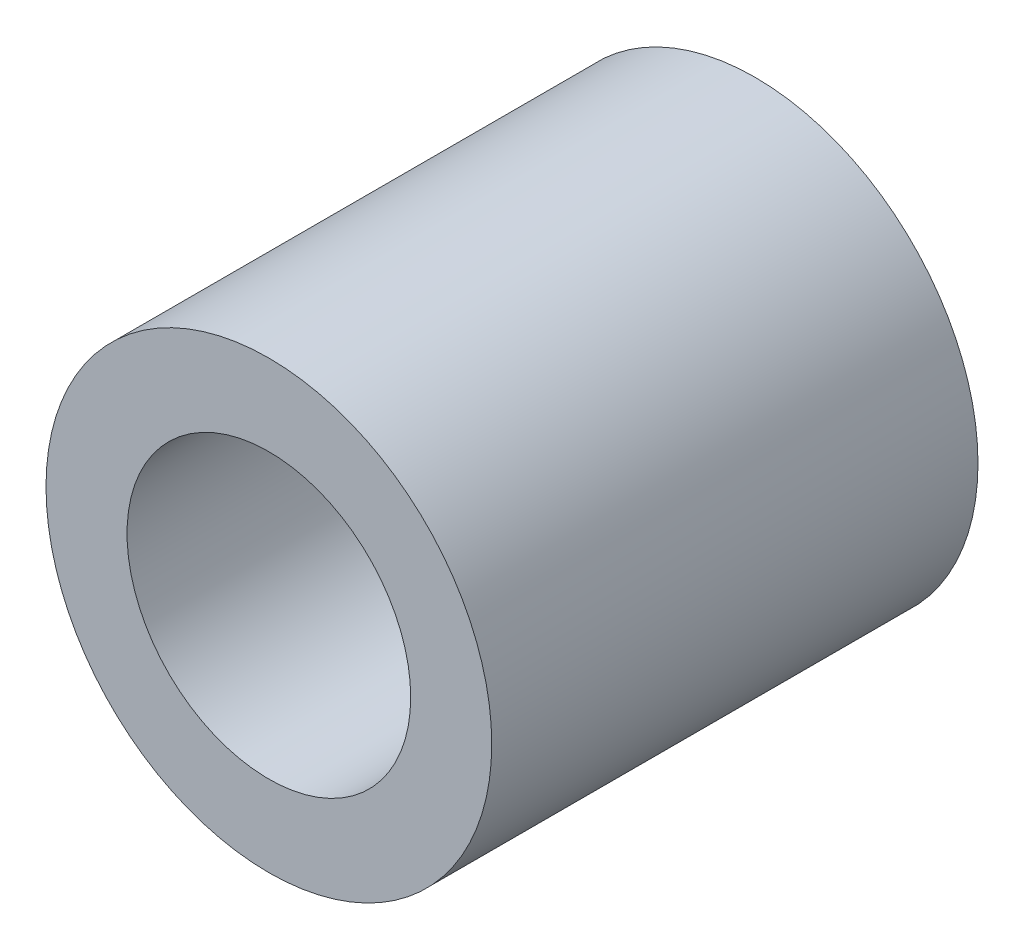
SolidWorks part; units mm, degrees
ref_plane "前视基准面" through (0, 0, 0) normal (0, 0, 1) x (1, 0, 0)
ref_plane "上视基准面" through (0, 0, 0) normal (0, 1, 0) x (1, 0, 0)
ref_plane "右视基准面" through (0, 0, 0) normal (1, 0, 0) x (0, 0, -1)
ref_plane "基准面1" through (0, 0, -6) normal (0, 0, 1) x (1, 0, 0)
ref_plane "基准面2" through (0, 0, 18) normal (0, 0, 1) x (1, 0, 0)
sketch "草图3" plane through (0, 0, -6) normal (0, 0, 1) x (1, 0, 0)
  line L0 (0, -4.0413) -> (0, 64.9005) construction
  line L1 (-27.9551, 32) -> (38.6747, 32) construction
  circle A0 centre (0, 32) radius 7
  circle A1 centre (0, 32) radius 11
  dimension "D2" = 22
  dimension "D3" = 14
  dimension "D1" = 32
extrude "凸台-拉伸2" add sketch "草图3" along normal blind 24 separate body
